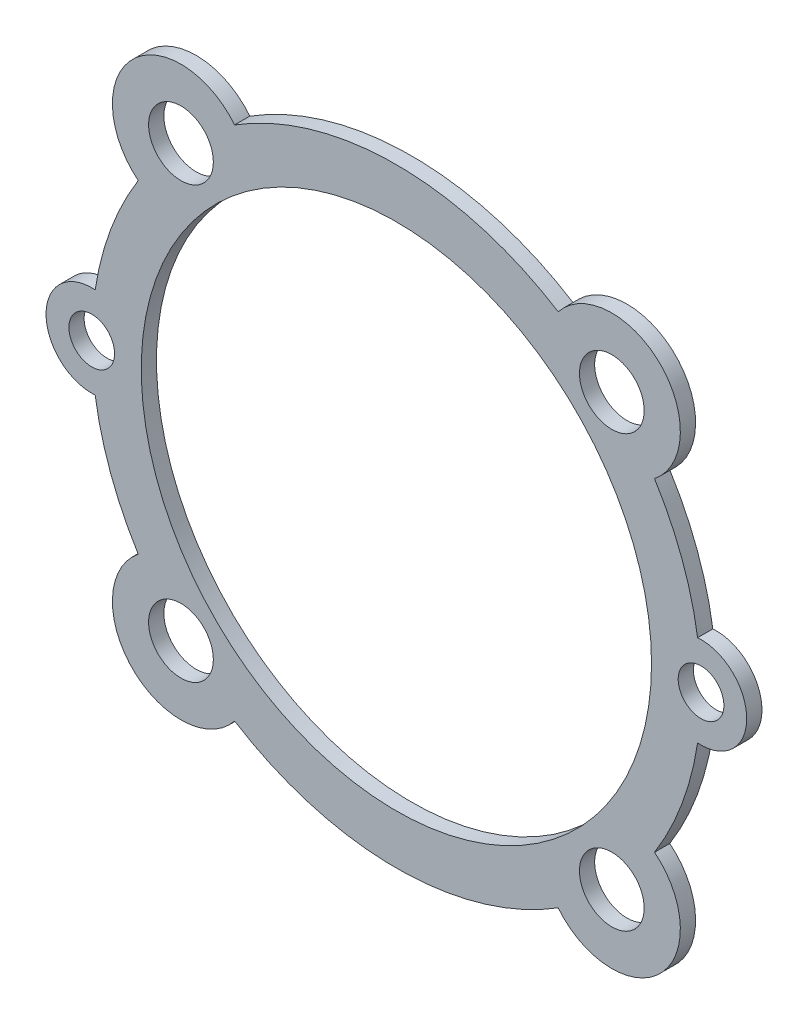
SolidWorks part; units mm, degrees
ref_plane "前视基准面" through (0, 0, 0) normal (0, 0, 1) x (1, 0, 0)
ref_plane "上视基准面" through (0, 0, 0) normal (0, 1, 0) x (1, 0, 0)
ref_plane "右视基准面" through (0, 0, 0) normal (1, 0, 0) x (0, 0, -1)
sketch "草图1" plane through (0, 0, 0) normal (0, 0, 1) x (1, 0, 0)
  circle A0 centre (0, 0) radius 33.5 construction
  arc A1 (33.8919, 21.2448) -> (21.2448, 33.8919) centre (28.2843, 28.2843) ccw construction
  arc A2 (39.55, 5.9831) -> (33.8919, 21.2448) centre (0, 0) ccw construction
  arc A3 (39.55, -5.9831) -> (39.55, 5.9831) centre (40, 0) ccw construction
  arc A4 (33.8919, -21.2448) -> (39.55, -5.9831) centre (0, 0) ccw construction
  arc A5 (21.2448, -33.8919) -> (33.8919, -21.2448) centre (28.2843, -28.2843) ccw construction
  arc A6 (-21.2448, -33.8919) -> (21.2448, -33.8919) centre (0, 0) ccw construction
  arc A7 (-33.8919, -21.2448) -> (-21.2448, -33.8919) centre (-28.2843, -28.2843) ccw construction
  arc A8 (-39.55, -5.9831) -> (-33.8919, -21.2448) centre (0, 0) ccw construction
  arc A9 (-39.55, 5.9831) -> (-39.55, -5.9831) centre (-40, 0) ccw construction
  arc A10 (-33.8919, 21.2448) -> (-39.55, 5.9831) centre (0, 0) ccw construction
  arc A11 (-21.2448, 33.8919) -> (-33.8919, 21.2448) centre (-28.2843, 28.2843) ccw construction
  arc A12 (21.2448, 33.8919) -> (-21.2448, 33.8919) centre (0, 0) ccw construction
  circle A13 centre (0, 0) radius 33.5
  arc A14 (33.8919, 21.2448) -> (21.2448, 33.8919) centre (28.2843, 28.2843) ccw
  arc A15 (39.55, 5.9831) -> (33.8919, 21.2448) centre (0, 0) ccw
  arc A16 (39.55, -5.9831) -> (39.55, 5.9831) centre (40, 0) ccw
  arc A17 (33.8919, -21.2448) -> (39.55, -5.9831) centre (0, 0) ccw
  arc A18 (21.2448, -33.8919) -> (33.8919, -21.2448) centre (28.2843, -28.2843) ccw
  arc A19 (-21.2448, -33.8919) -> (21.2448, -33.8919) centre (0, 0) ccw
  arc A20 (-33.8919, -21.2448) -> (-21.2448, -33.8919) centre (-28.2843, -28.2843) ccw
  arc A21 (-39.55, -5.9831) -> (-33.8919, -21.2448) centre (0, 0) ccw
  arc A22 (-39.55, 5.9831) -> (-39.55, -5.9831) centre (-40, 0) ccw
  arc A23 (-33.8919, 21.2448) -> (-39.55, 5.9831) centre (0, 0) ccw
  arc A24 (-21.2448, 33.8919) -> (-33.8919, 21.2448) centre (-28.2843, 28.2843) ccw
  arc A25 (21.2448, 33.8919) -> (-21.2448, 33.8919) centre (0, 0) ccw
extrude "拉伸1" add sketch "草图1" along normal blind 2
hole_wizard "M10 螺纹孔1" positions "草图3" profile "草图2" tap size "M10" standard "ISO"
sketch "草图3" plane through (0, 0, 2) normal (0, 0, 1) x (1, 0, 0)
  point P1 (-28.2843, 28.2843)
  point P4 (28.2843, 28.2843)
  point P7 (28.2843, -28.2843)
  point P10 (-28.2843, -28.2843)
sketch "草图2" plane through (-28.2843, 28.2843, 2) normal (1, 0, 0) x (0, -1, 0)
  line L0 (0, 0) -> (0, 2)
  line L1 (0, 2) -> (4.25, 2)
  line L2 (4.25, 2) -> (4.25, 0)
  line L5 (4.25, 0) -> (0, 0)
  line L11 (0, -6.35) -> (0, 107.95) construction
  dimension "籵謂蹟恇謂郰芛眻噤" = 8.5
  dimension "籵謂蹟恇謂郰芛旮僅" = 2
sketch "草图4" plane through (0, 0, 2) normal (0, 0, 1) x (1, 0, 0)
  circle A0 centre (40, 0) radius 3
  circle A1 centre (-40, 0) radius 3
  dimension "D1" = 6
  dimension "D2" = 6
extrude "切除-拉伸1" cut sketch "草图4" against normal through all
